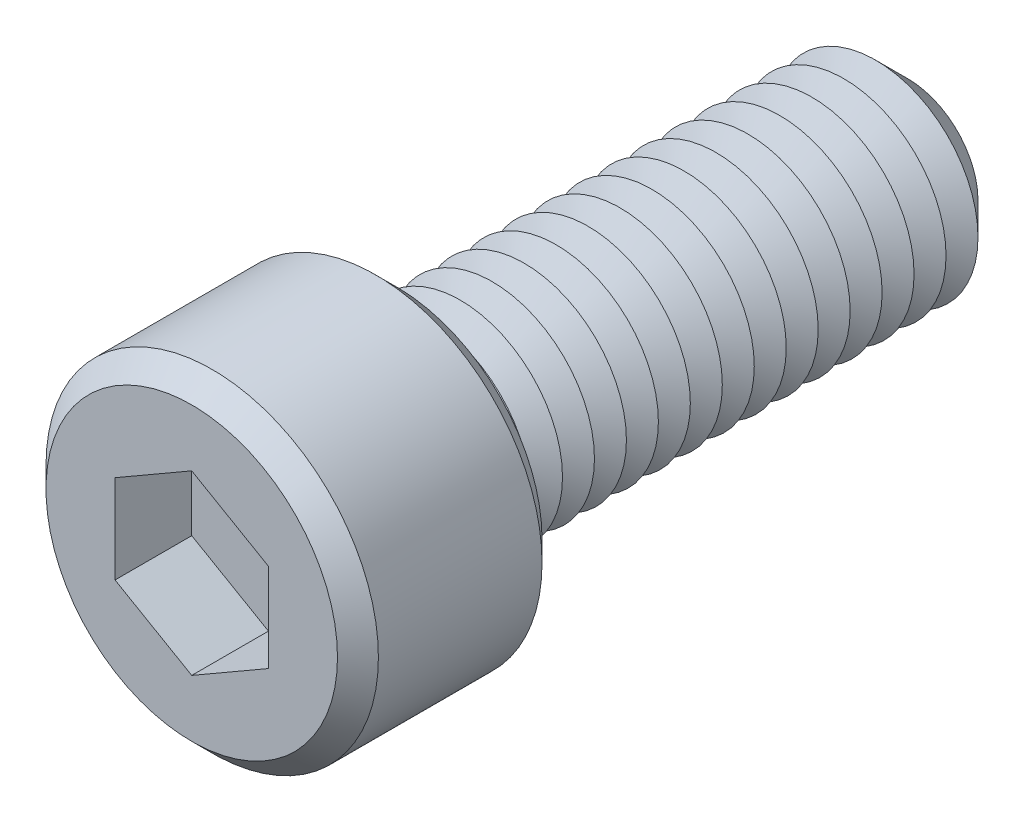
SolidWorks part; units mm, degrees
ref_plane "Front Plane" through (0, 0, 0) normal (0, 0, 1) x (1, 0, 0)
ref_plane "Top Plane" through (0, 0, 0) normal (0, 1, 0) x (1, 0, 0)
ref_plane "Right Plane" through (0, 0, 0) normal (1, 0, 0) x (0, 0, -1)
sketch "Sketch1" plane through (0, 0, 0) normal (0, 0, 1) x (1, 0, 0)
  circle A0 centre (0, 0) radius 6.5
  dimension "D1" = 13
extrude "Boss-Extrude1" add sketch "Sketch1" along normal blind 8
sketch "Sketch2" plane through (0, 0, 0) normal (0, 0, -1) x (-1, 0, 0)
  circle A0 centre (0, 0) radius 4
  dimension "D1" = 8
extrude "Boss-Extrude2" add sketch "Sketch2" along normal blind 20
chamfer "Chamfer1" distance 1.25 angle 45 1 edges at (-4, 0, -20)
sketch "Sketch3" plane through (0, 0, 0) normal (1, 0, 0) x (0, 0, -1)
  line L0 (-2.5121, 0) -> (4.5776, 0) construction
sketch "Sketch4" plane through (0, 0, 0) normal (1, 0, 0) x (0, 0, -1)
  line L0 (0, 4) -> (0.625, 2.9175)
  line L1 (0.625, 2.9175) -> (1.25, 4)
  line L2 (18.75, 4) -> (0, 4) construction
  line L3 (1.25, 4) -> (0, 4)
  dimension "D1" = 1.25
revolve "Cut-Revolve1" cut sketch "Sketch4" angle 360 about L0
pattern_linear "LPattern1" count 15 spacing 1.25 along (0, 0, -1) of "Cut-Revolve1"
sketch "Sketch5" plane through (0, 0, 8) normal (0, 0, 1) x (1, 0, 0)
  line L1 (0, 3.4641) -> (-3, 1.7321)
  line L2 (-3, 1.7321) -> (-3, -1.7321)
  line L3 (-3, -1.7321) -> (0, -3.4641)
  line L4 (0, -3.4641) -> (3, -1.7321)
  line L5 (3, -1.7321) -> (3, 1.7321)
  line L6 (3, 1.7321) -> (0, 3.4641)
  circle A0 centre (0, 0) radius 3 construction
  dimension "D1" = 6
extrude "Cut-Extrude1" cut sketch "Sketch5" against normal blind 3
sketch "Sketch6" plane through (0, 0, 5) normal (0, 0, 1) x (1, 0, 0)
  circle A0 centre (0, 0) radius 0.9
  dimension "D1" = 1.8
extrude "Cut-Extrude2" cut sketch "Sketch6" against normal up to surface (25 mm away)
chamfer "Chamfer2" distance 0.8 angle 45 2 edges at (6.5, 0, 0) (6.5, 0, 8)
